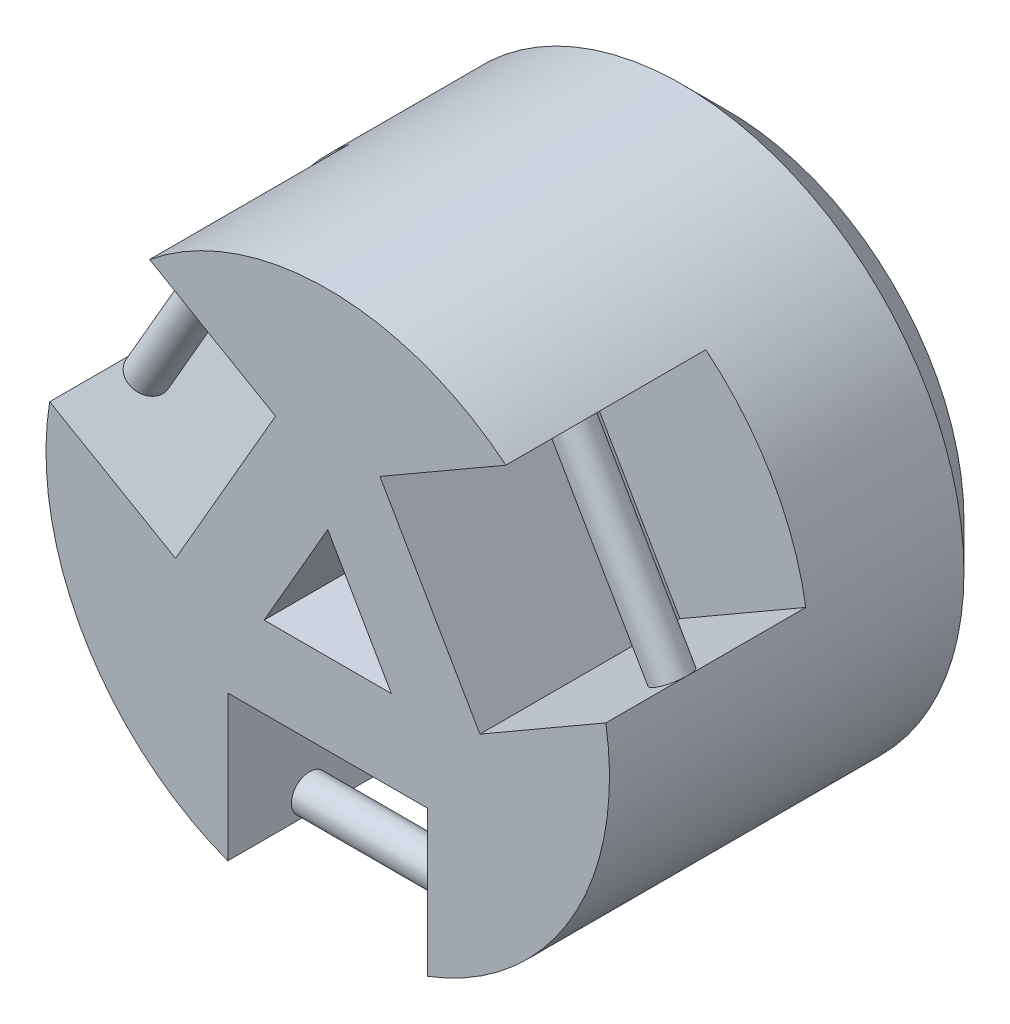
SolidWorks part; units mm, degrees
ref_plane "Plan de face" through (0, 0, 0) normal (0, 0, 1) x (1, 0, 0)
ref_plane "Plan de dessus" through (0, 0, 0) normal (0, 1, 0) x (1, 0, 0)
ref_plane "Plan de droite" through (0, 0, 0) normal (1, 0, 0) x (0, 0, -1)
sketch "Esquisse1" plane through (0, 0, 0) normal (0, 0, 1) x (1, 0, 0)
  circle A0 centre (0, 0) radius 15.5
  dimension "D1" = 31
extrude "Boss.-Extru.1" add sketch "Esquisse1" along normal blind 22
chamfer "Chanfrein1" distance 2.5 angle 45 1 edges at (15.5, 0, 0)
sketch "Esquisse2" plane through (0, 0, 0) normal (0, 0, -1) x (-1, 0, 0)
  circle A0 centre (0, 0) radius 3
  dimension "D1" = 6
extrude "Boss.-Extru.2" add sketch "Esquisse2" along normal blind 5
chamfer "Chanfrein2" distance 1 angle 45 1 edges at (-3, 0, -5)
sketch "Esquisse3" plane through (0, 0, 22) normal (0, 0, 1) x (1, 0, 0)
  line L0 (0, 0) -> (0, -16.9725) construction
  line L2 (-5.5, -6.4914) -> (5.5, -6.4914)
  line L3 (-5.5, -6.4914) -> (-5.5, -14.4914)
  line L5 (5.5, -6.4914) -> (5.5, -14.4914)
  line L6 (-5.5, -6.4914) -> (5.5, -14.4914) construction
  line L7 (-5.5, -14.4914) -> (5.5, -6.4914) construction
  circle A0 centre (0, 0) radius 15.5 construction
  arc A1 (-5.5, -14.4914) -> (5.5, -14.4914) centre (0, 0) ccw
  point P3 (0, -10.4914)
  point P8 (0, 0)
  dimension "D1" = 11
  dimension "D2" = 8
extrude "Enlèv. mat.-Extru.1" cut sketch "Esquisse3" against normal blind 11
pattern_circular "Répétition circulaire1" count 3 over 360 about axis through (0, 0, 0) along (0, 0, 1) of "Enlèv. mat.-Extru.1"
sketch "Esquisse4" plane through (0, 0, 22) normal (0, 0, 1) x (1, 0, 0)
  line L0 (-3.5, -2.0207) -> (0, 4.0415)
  line L1 (0, 4.0415) -> (3.5, -2.0207)
  line L2 (3.5, -2.0207) -> (-3.5, -2.0207)
  line L3 (0, -2.0207) -> (0, 4.0415) construction
  line L4 (-3.5, -2.0207) -> (1.75, 1.0104) construction
  dimension "D1" = 7
extrude "Enlèv. mat.-Extru.2" cut sketch "Esquisse4" against normal blind 21
sketch "Esquisse5" plane through (0, 0, 0) normal (1, 0, 0) x (0, 0, -1)
  line L0 (-11, -14.4914) -> (-11, -15.5) construction
  line L1 (-11, -6.4914) -> (-22, -6.4914) construction
  circle A0 centre (-17.5, -13.4914) radius 1
  dimension "D3" = 2
  dimension "D1" = 6.5
  dimension "D2" = 7
extrude "Boss.-Extru.4" add sketch "Esquisse5" along normal mid plane 11 contours A0
pattern_circular "Répétition circulaire2" count 3 over 360 about axis through (0, 0, -5) along (0, 0, 1) of "Boss.-Extru.4"
